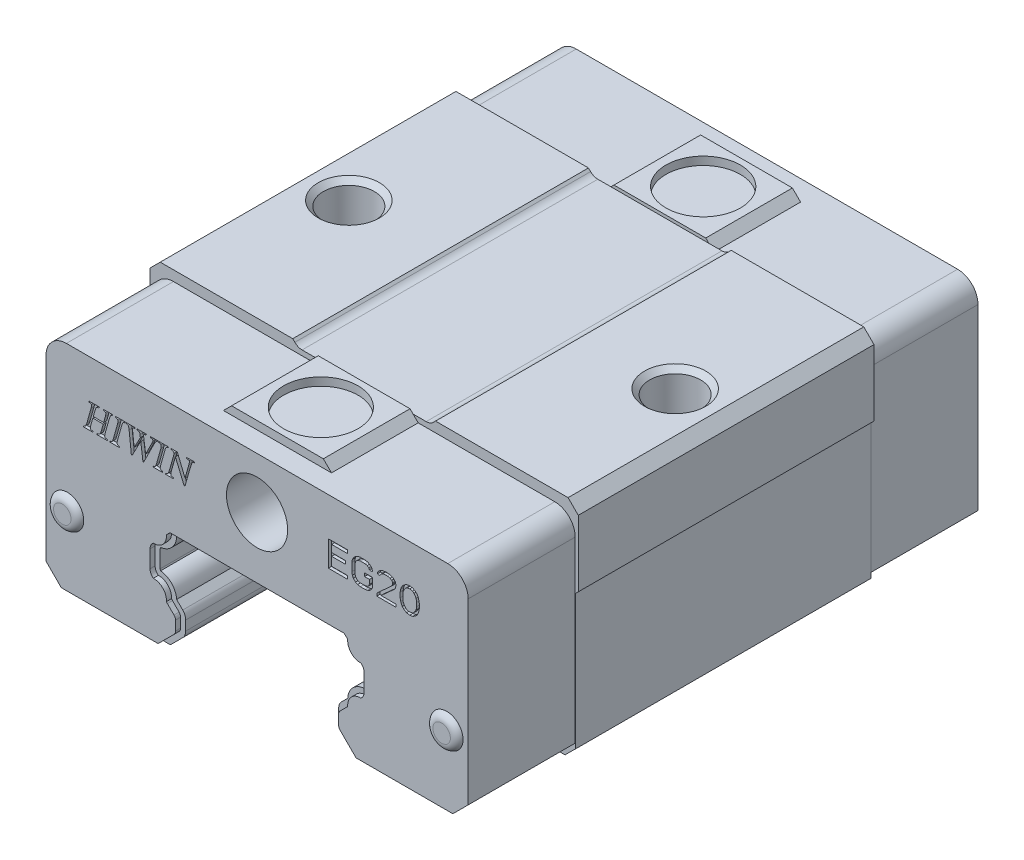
SolidWorks part; units mm, degrees
ref_plane "前视基准面" through (0, 0, 0) normal (0, 0, 1) x (1, 0, 0)
ref_plane "上视基准面" through (0, 0, 0) normal (0, 1, 0) x (1, 0, 0)
ref_plane "右视基准面" through (0, 0, 0) normal (1, 0, 0) x (0, 0, -1)
imported_body "输入1"
sketch "草图1" plane through (0, 0, 39.5) normal (0, 0, 1) x (1, 0, 0)
  line L0 (0, 12.5) -> (0, -15.5) construction
  line L1 (-7, 12.5) -> (-20, 12.5) construction
  line L23 (-7.5, -6.6484) -> (-7.5, -7.5857)
  line L24 (-9, -15.5) -> (-3, -15.5)
  line L25 (10, -14.5) -> (10, -11.1213)
  line L26 (-8.3342, 0) -> (-8.3896, -0.0554)
  line L27 (-10, -11.1213) -> (-10, -14.5)
  line L28 (7.7929, -5.9413) -> (8.3896, -5.3446)
  line L29 (8.3896, -0.0554) -> (8.3342, 0)
  line L30 (-2.5, -15) -> (2.5, -15)
  line L31 (9, -15.5) -> (10, -14.5)
  line L32 (10, -3.547) -> (10, -1.853)
  line L33 (-7.7929, -8.2928) -> (-9.5607, -10.0606)
  line L34 (-3, -15.5) -> (3, -15.5) construction
  line L35 (-8.3896, -5.3446) -> (-7.7929, -5.9413)
  line L36 (-3, -15.5) -> (-2.5, -15)
  line L37 (2.5, -15) -> (3, -15.5)
  line L38 (7.5, -7.5857) -> (7.5, -6.6484)
  line L39 (8.3342, 0) -> (-8.3342, 0)
  line L40 (-10, -1.853) -> (-10, -3.547)
  line L41 (9.5607, -10.0606) -> (7.7929, -8.2928)
  line L42 (-10, -14.5) -> (-9, -15.5)
  line L43 (3, -15.5) -> (9, -15.5)
  arc A14 (-8.3896, -5.3446) -> (-9.9603, -3.6961) centre (-10.1371, -5.4371) ccw
  arc A15 (-10, -3.547) -> (-9.9603, -3.6961) centre (-9.7, -3.547) ccw
  arc A16 (-7.5, -6.6484) -> (-7.7929, -5.9413) centre (-8.5, -6.6484) ccw
  arc A17 (-9.5607, -10.0606) -> (-10, -11.1213) centre (-8.5, -11.1213) ccw
  arc A18 (9.9603, -3.6961) -> (10, -3.547) centre (9.7, -3.547) ccw
  arc A19 (-7.7929, -8.2928) -> (-7.5, -7.5857) centre (-8.5, -7.5857) ccw
  arc A20 (7.5, -7.5857) -> (7.7929, -8.2928) centre (8.5, -7.5857) ccw
  arc A21 (7.7929, -5.9413) -> (7.5, -6.6484) centre (8.5, -6.6484) ccw
  arc A22 (10, -1.853) -> (9.9603, -1.7039) centre (9.7, -1.853) ccw
  arc A23 (-9.9603, -1.7039) -> (-8.3896, -0.0554) centre (-10.1371, 0.0371) ccw
  arc A24 (9.9603, -3.6961) -> (8.3896, -5.3446) centre (10.1371, -5.4371) ccw
  arc A25 (-9.9603, -1.7039) -> (-10, -1.853) centre (-9.7, -1.853) ccw
  arc A26 (8.3896, -0.0554) -> (9.9603, -1.7039) centre (10.1371, 0.0371) ccw
  arc A27 (10, -11.1213) -> (9.5607, -10.0606) centre (8.5, -11.1213) ccw
  dimension "D1" = 28
extrude "切除-拉伸1" cut sketch "草图1" against normal through all
sketch "草图2" plane through (0, 0, 29) normal (0, 0, 1) x (1, 0, 0)
  line L0 (20.7, 4.7) -> (21, 5) construction
  line L1 (20.7, -8.5) -> (20.71, -8.5)
  line L2 (20.7, -8.5) -> (20.7, 4.71)
  line L3 (20.7, 4.71) -> (20.71, 4.71)
  line L4 (20.71, -8.5) -> (20.71, 4.71)
  dimension "D1" = 0.01
extrude "凸台-拉伸1" add sketch "草图2" against normal up to surface (29 mm away)
